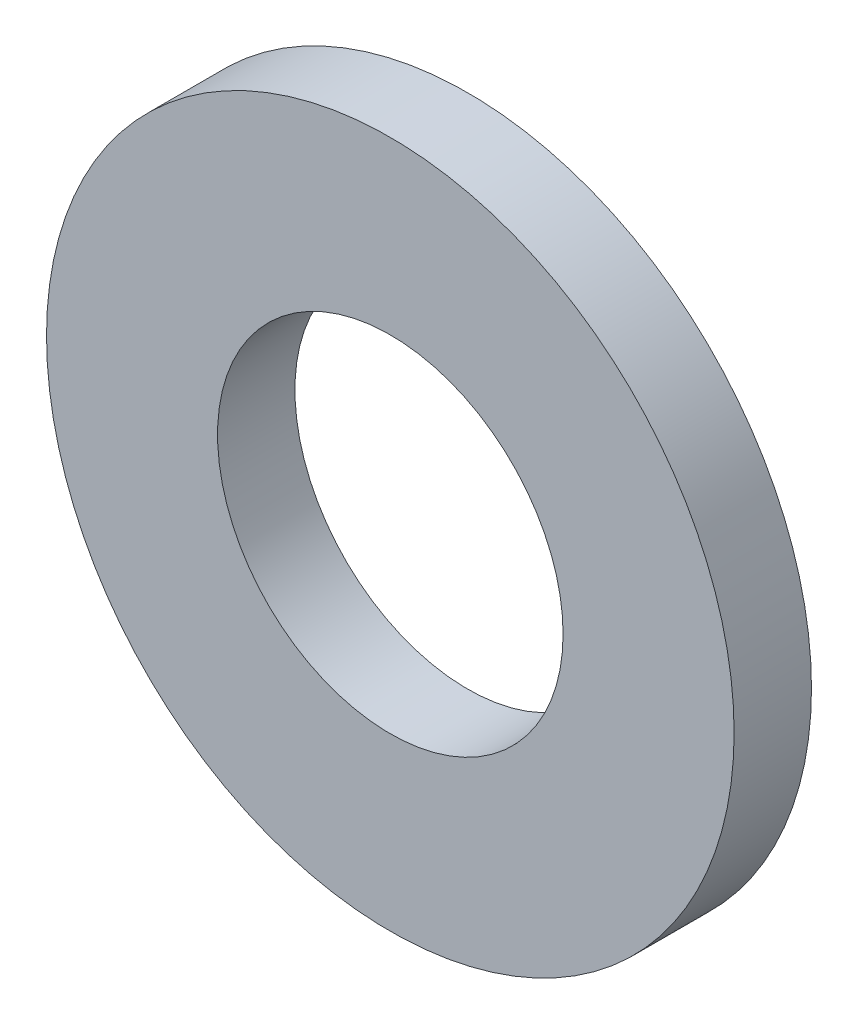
SolidWorks part; units mm, degrees
ref_plane "Plan de face" through (0, 0, 0) normal (0, 0, 1) x (1, 0, 0)
ref_plane "Plan de dessus" through (0, 0, 0) normal (0, 1, 0) x (1, 0, 0)
ref_plane "Plan de droite" through (0, 0, 0) normal (1, 0, 0) x (0, 0, -1)
sketch "Esquisse1" plane through (0, 0, 0) normal (0, 0, 1) x (1, 0, 0)
  circle A0 centre (0, 0) radius 20
  circle A1 centre (0, 0) radius 10.05
  dimension "D1" = 40
  dimension "D2" = 20.1
extrude "Extrusion1" add sketch "Esquisse1" along normal blind 4.5
